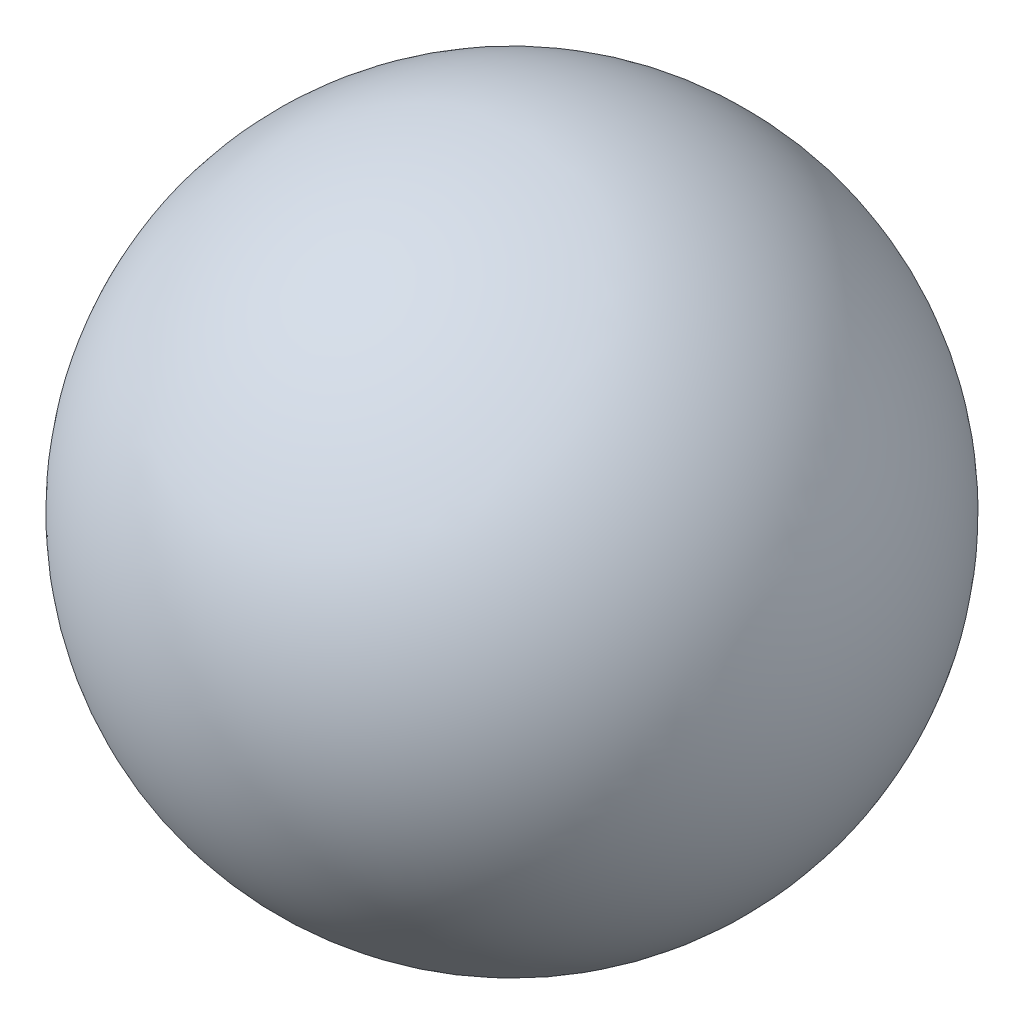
SolidWorks part; units mm, degrees
ref_plane "Face" through (0, 0, 0) normal (0, 0, 1) x (1, 0, 0)
ref_plane "Dessus" through (0, 0, 0) normal (0, 1, 0) x (1, 0, 0)
ref_plane "Droite" through (0, 0, 0) normal (1, 0, 0) x (0, 0, -1)
sketch "Esquisse1" plane through (0, 0, 0) normal (0, 0, 1) x (1, 0, 0)
  line L0 (-3.5, 0) -> (3.5, 0)
  line L1 (-4.415, 0) -> (4.415, 0) construction
  arc A0 (3.5, 0) -> (-3.5, 0) centre (0, 0) ccw
  dimension "D1" = 7
revolve "Base-Révolution" add sketch "Esquisse1" angle 360 about L1
sketch "Esq_WRNL_Compact001" plane through (0, 0, 0) normal (0, 0, 1) x (1, 0, 0)
  line L0 (-4.5, -4.5) -> (-4.5, 4.5)
  line L1 (4.5, -4.5) -> (4.5, 4.5)
  line L2 (-4.5, -4.5) -> (4.5, -4.5)
  line L3 (-4.5, 4.5) -> (4.5, 4.5)
